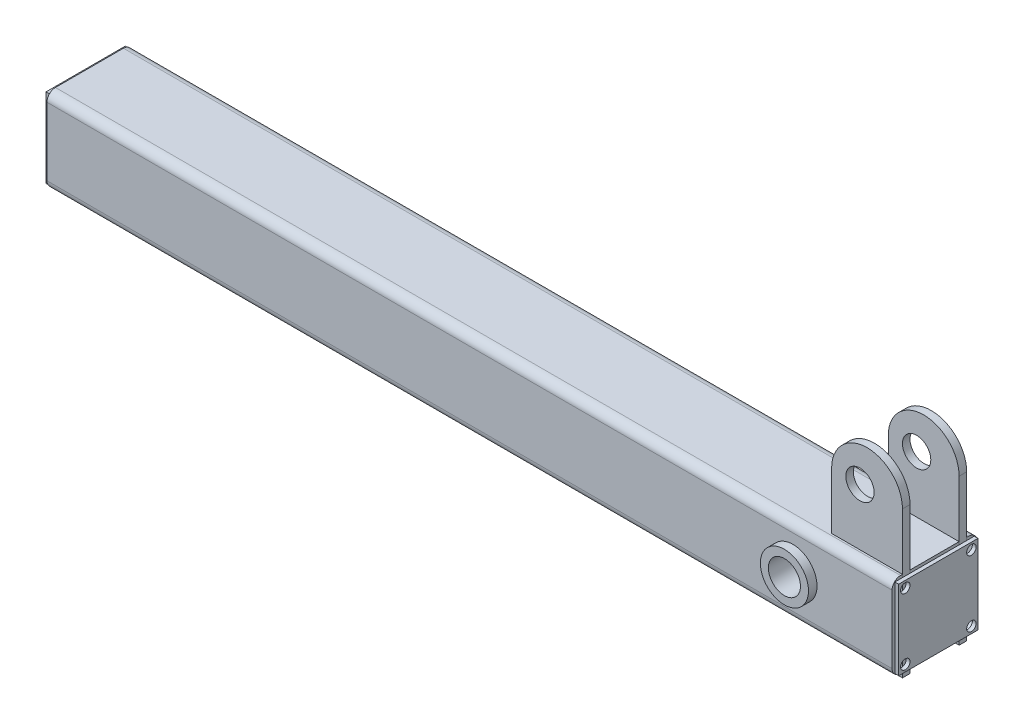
SolidWorks part; units mm, degrees
ref_plane "Ebene vorne" through (0, 0, 0) normal (0, 0, 1) x (1, 0, 0)
ref_plane "Ebene oben" through (0, 0, 0) normal (0, 1, 0) x (1, 0, 0)
ref_plane "Ebene rechts" through (0, 0, 0) normal (1, 0, 0) x (0, 0, -1)
sketch "Skizze_Stützenrohr" plane through (0, 0, 0) normal (0, 0, 1) x (1, 0, 0)
  line L0 (0, 0) -> (895, 0)
  dimension "D1" = 895
other "QR_90x3,6_1"
ref_plane "Ebene1" through (0, 0, 0) normal (1, 0, 0) x (0, 1, 0)
sketch "Skizze11" plane through (0, 0, 0) normal (1, 0, 0) x (0, 1, 0)
  line L0 (-36, 41.4) -> (36, 41.4)
  line L1 (-36, 45) -> (36, 45)
  line L2 (-45, 36) -> (-45, -36)
  line L3 (-36, -45) -> (36, -45)
  line L4 (45, 36) -> (45, -36)
  line L5 (41.4, 36) -> (41.4, -36)
  line L6 (-36, -41.4) -> (36, -41.4)
  line L7 (-41.4, 36) -> (-41.4, -36)
  line L8 (0, 45) -> (0, -45) construction
  arc A0 (-36, 45) -> (-45, 36) centre (-36, 36) ccw
  arc A1 (36, 45) -> (45, 36) centre (36, 36) cw
  arc A2 (36, -45) -> (45, -36) centre (36, -36) ccw
  arc A3 (-45, -36) -> (-36, -45) centre (-36, -36) ccw
  arc A4 (36, 41.4) -> (41.4, 36) centre (36, 36) cw
  arc A5 (36, -41.4) -> (41.4, -36) centre (36, -36) ccw
  arc A6 (-41.4, -36) -> (-36, -41.4) centre (-36, -36) ccw
  arc A7 (-36, 41.4) -> (-41.4, 36) centre (-36, 36) ccw
  point P20 (-45, 45)
  point P21 (45, 45)
  point P22 (-45, -45)
  point P23 (45, -45)
  point P25 (-45, 0)
  point P26 (45, 0)
  point P27 (0, -45)
  point P28 (0, 45)
  point P30 (0, 0)
  dimension "r" = 9
  dimension "a" = 90
  dimension "s" = 3.6
  dimension "b" = 90
sketch "Skizze12" plane through (0, 0, 45) normal (0, 0, 1) x (1, 0, 0)
  line L0 (0, 0) -> (895, 0) construction
  line L1 (895, 36) -> (895, -36) construction
  circle A0 centre (790, 0) radius 25.5
  dimension "D1" = 105
  dimension "D2" = 51
extrude "Schnitt-Linear austragen1" cut sketch "Skizze12" against normal up to surface (90 mm away)
ref_plane "Ebene_Blech_rechts" through (0, 0, 34) normal (0, 0, 1) x (1, 0, 0)
sketch "Skizze13" plane through (0, 0, 34) normal (0, 0, 1) x (1, 0, 0)
  line L0 (895, 45) -> (0, 45) construction
  line L1 (895, -50) -> (820, -50)
  line L2 (895, -50) -> (895, 105)
  line L3 (895, 36) -> (895, -36) construction
  line L4 (820, -50) -> (820, 105)
  arc A0 (895, 105) -> (820, 105) centre (857.5, 105) ccw
  dimension "D1" = 75
  dimension "D2" = 60
  dimension "D3" = 155
sheet metal parameters "Blech_Anlenkung" thickness 8 parameters "D1"=0.7366
base flange "Basis-Blech1" sketch "Skizze13" thickness 8 reverse thickness direction no parameters "D1"=0.7366
hole_wizard "Ø30.0 (30) Durchmesser Bohrung1" positions "Skizze17" profile "Skizze16" hole size "Ø30.0" standard "DIN"
sketch "Skizze17" plane through (0, 0, 34) normal (0, 0, 1) x (1, 0, 0)
  line L1 (895, -50) -> (895, 105) construction
  line L2 (895, 45) -> (0, 45) construction
  point P0 (850, 105)
  dimension "D1" = 60
  dimension "D2" = 45
sketch "Skizze16" plane through (850, 105, 34) normal (1, 0, 0) x (0, -1, 0)
  line L0 (0, 0) -> (0, 8)
  line L1 (0, 8) -> (15, 8)
  line L2 (15, 8) -> (15, 0)
  line L5 (15, 0) -> (0, 0)
  line L11 (0, -6.35) -> (0, 107.95) construction
  dimension "Bohrerdurchmesser" = 30
  dimension "Bohrungstiefe" = 8
mirror "Spiegeln_Blech_Anlenkung" about plane through (0, 0, 0) normal (0, 0, 1)
other "Einbuchtung3" parameters "D1"=10, "D2"=0
sketch3d "Skizze_Buchse"
  line L0 (790, 0, 54) -> (790, 0, -54)
  line L1 (790, 0, 41.4) -> (790, 0, 45) construction
  line L2 (790, 0, -45) -> (790, 0, -41.4) construction
  dimension "D1" = 108
  dimension "D2" = 9
other "RO_51x12_1"
ref_plane "Ebene3" through (790, 0, 54) normal (0, 0, -1) x (1, 0, 0)
sketch "Skizze14" plane through (790, 0, 54) normal (0, 0, -1) x (1, 0, 0)
  circle A0 centre (0, 0) radius 25.5
  circle A1 centre (0, 0) radius 13.5
  point P2 (0, 0)
  point P4 (25.5, 0)
  point P5 (0, -25.5)
  point P6 (-25.5, 0)
  point P7 (0, 25.5)
  point P8 (0, 13.5)
  point P9 (0, -13.5)
  point P10 (-13.5, 0)
  point P11 (13.5, 0)
  point P12 (0, 0)
  dimension "Da" = 51
  dimension "s" = 12
hole_wizard "Ø34.0 (34) Durchmesser Bohrung1" positions "Skizze19" profile "Skizze18" hole size "Ø34.0" standard "DIN"
sketch "Skizze19" plane through (0, 0, 54) normal (0, 0, 1) x (1, 0, 0)
  point P0 (790, 0)
sketch "Skizze18" plane through (790, 0, 54) normal (1, 0, 0) x (0, -1, 0)
  line L0 (0, 0) -> (0, 40.2146)
  line L1 (0, 40.2146) -> (17, 30)
  line L2 (17, 30) -> (17, 0)
  line L5 (17, 0) -> (0, 0)
  line L10 (0, 40.2146) -> (-17, 30) construction
  line L11 (0, -6.35) -> (0, 107.95) construction
  dimension "Bohrerdurchmesser" = 34
  dimension "Bohrungstiefe" = 30
  dimension "Spitzenwinkel" = 118
hole_wizard "Ø34.0 (34) Durchmesser Bohrung2" positions "Skizze21" profile "Skizze20" hole size "Ø34.0" standard "DIN"
sketch "Skizze21" plane through (0, 0, -54) normal (0, 0, -1) x (-1, 0, 0)
  point P0 (-790, 0)
sketch "Skizze20" plane through (790, 0, -54) normal (1, 0, 0) x (0, 1, 0)
  line L0 (0, 0) -> (0, 40.2146)
  line L1 (0, 40.2146) -> (17, 30)
  line L2 (17, 30) -> (17, 0)
  line L5 (17, 0) -> (0, 0)
  line L10 (0, 40.2146) -> (-17, 30) construction
  line L11 (0, -6.35) -> (0, 107.95) construction
  dimension "Bohrerdurchmesser" = 34
  dimension "Bohrungstiefe" = 30
  dimension "Spitzenwinkel" = 118
sketch "Skizze22" plane through (0, 0, 0) normal (-1, 0, 0) x (0, 0, 1)
  line L0 (0, 0) -> (19.3843, 0) construction
  line L1 (-42, 42) -> (42, 42)
  line L2 (-42, 42) -> (-42, -42)
  line L3 (-42, -42) -> (42, -42)
  line L4 (42, 42) -> (42, -42)
  line L5 (0, 0) -> (0, 18.0226) construction
  dimension "D1" = 84
sheet metal parameters "Blech_Abdeckung" thickness 4 parameters "D1"=0.7366
base flange "Basis-Blech2" sketch "Skizze22" thickness 4 reverse thickness direction yes parameters "D1"=0.7366
hole_wizard "Ø10.0 (10) Durchmesser Bohrung1" positions "Skizze26" profile "Skizze25" hole size "Ø10.0" standard "DIN"
sketch "Skizze26" plane through (-4, 0, 0) normal (-1, 0, 0) x (0, 0, 1)
  line L0 (0, 42) -> (0, -42) construction
  line L1 (42, 42) -> (-42, 42) construction
  line L2 (-42, -42) -> (42, -42) construction
  line L4 (-42, 0) -> (42, 0) construction
  line L5 (-42, 42) -> (-42, -42) construction
  line L6 (42, -42) -> (42, 42) construction
  point P0 (35, 35)
  point P1 (-35, 35)
  point P3 (-35, -35)
  point P5 (35, -35)
  dimension "D1" = 70
  dimension "D2" = 70
sketch "Skizze25" plane through (-4, 35, 35) normal (0, 1, 0) x (0, 0, 1)
  line L0 (0, 0) -> (0, 4)
  line L1 (0, 4) -> (5, 4)
  line L2 (5, 4) -> (5, 0)
  line L5 (5, 0) -> (0, 0)
  line L11 (0, -6.35) -> (0, 107.95) construction
  dimension "Bohrerdurchmesser" = 10
  dimension "Bohrungstiefe" = 4
ref_plane "Ebene_Mitte_Rohr" through (447.5, 0, 0) normal (1, 0, 0) x (0, 0, -1)
mirror "Spiegeln_Abdeckung" about plane through (447.5, 0, 0) normal (1, 0, 0)
flat pattern "Abwicklung1"
sketch "Biegung-Linien1" plane through (0, 0, 0) normal (0, 1, 0) x (-1, 0, 0)
sketch3d "Rahmen1" [suppressed]
  line L0 (-37.5, 37.5, 0) -> (-37.5, -60, 0) construction
  line L1 (37.5, 37.5, 0) -> (37.5, -60, 0) construction
  line L2 (-37.5, 37.5, 0) -> (37.5, 37.5, 0) construction
  line L3 (-37.5, -60, 0) -> (37.5, -60, 0) construction
flat pattern "Abwicklung2"
sketch "Biegung-Linien2" plane through (0, 0, 0) normal (0, 1, 0) x (-1, 0, 0)
sketch "Rahmen2" [suppressed] plane through (0, 0, 0) normal (0, 1, 0) x (-1, 0, 0)
